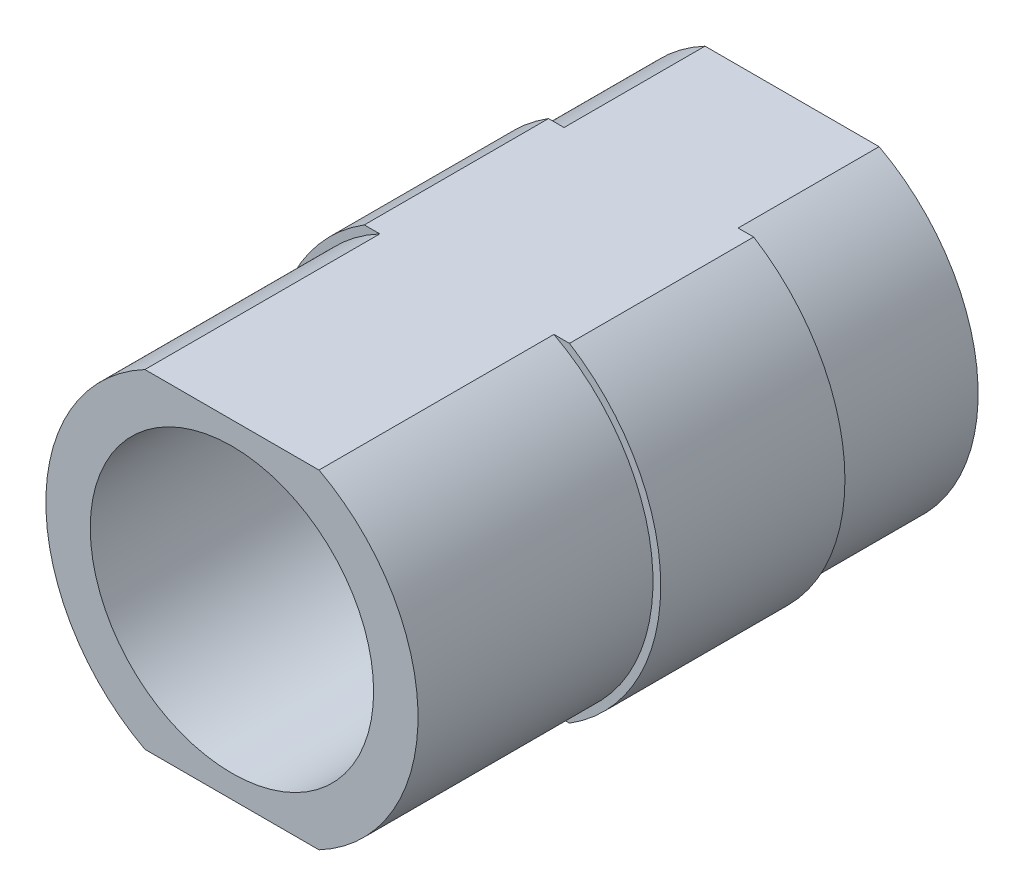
SolidWorks part; units mm, degrees
ref_plane "Plan de face" through (0, 0, 0) normal (0, 0, 1) x (1, 0, 0)
ref_plane "Plan de dessus" through (0, 0, 0) normal (0, 1, 0) x (1, 0, 0)
ref_plane "Plan de droite" through (0, 0, 0) normal (1, 0, 0) x (0, 0, -1)
sketch "Esquisse1" plane through (0, 0, 0) normal (0, 0, 1) x (1, 0, 0)
  circle A0 centre (0, 0) radius 4.125
  dimension "D1" = 8.25
extrude "Extrusion1" add sketch "Esquisse1" along normal blind 11.92
sketch "Esquisse2" plane through (0, 0, 11.92) normal (0, 0, 1) x (1, 0, 0)
  circle A0 centre (0, 0) radius 3.015
  dimension "D1" = 6.03
extrude "Enlèv. mat.-Extru.1" cut sketch "Esquisse2" against normal through all
sketch "Esquisse3" plane through (0, 0, 11.92) normal (0, 0, 1) x (1, 0, 0)
  circle A0 centre (0, 0) radius 3.96
  circle A1 centre (0, 0) radius 4.125
  dimension "D1" = 7.92
extrude "Enlèv. mat.-Extru.3" cut sketch "Esquisse3" against normal blind 5
sketch "Esquisse4" plane through (0, 0, 0) normal (0, 0, -1) x (-1, 0, 0)
  circle A0 centre (0, 0) radius 3.96
  circle A1 centre (0, 0) radius 4.125
  dimension "D1" = 7.92
extrude "Enlèv. mat.-Extru.4" cut sketch "Esquisse4" against normal blind 3
sketch "Esquisse7" plane through (0, 0, 11.92) normal (0, 0, 1) x (1, 0, 0)
  line L0 (0, 4.125) -> (0, -4.125) construction
  line L1 (-4.125, 0) -> (4.125, 0) construction
  line L2 (-2.183, 3.5) -> (0, 3.5)
  line L3 (0, 3.5) -> (2.183, 3.5)
  line L4 (0, -3.5) -> (2.183, -3.5)
  line L5 (-2.183, -3.5) -> (0, -3.5)
  circle A0 centre (0, 0) radius 4.125 construction
  circle A1 centre (0, 0) radius 4.125
  dimension "D1" = 3.5
extrude "Enlèv. mat.-Extru.5" cut sketch "Esquisse7" against normal through all
